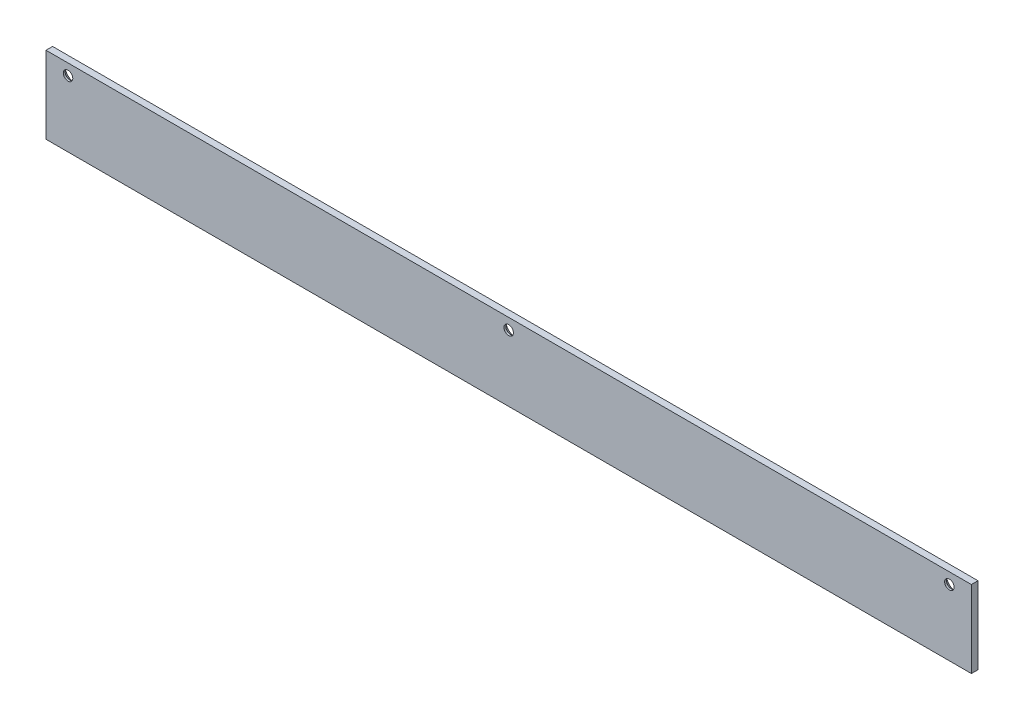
SolidWorks part; units mm, degrees
ref_plane "Спереди" through (0, 0, 0) normal (0, 0, 1) x (1, 0, 0)
ref_plane "Сверху" through (0, 0, 0) normal (0, 1, 0) x (1, 0, 0)
ref_plane "Справа" through (0, 0, 0) normal (1, 0, 0) x (0, 0, -1)
sketch "Эскиз1" plane through (0, 0, 0) normal (0, 0, 1) x (1, 0, 0)
  line L1 (0, 0) -> (420, 0)
  line L2 (0, 0) -> (0, 35)
  line L3 (0, 35) -> (420, 35)
  line L4 (420, 0) -> (420, 35)
  dimension "D1" = 35
  dimension "D2" = 420
extrude "Бобышка-Вытянуть1" add sketch "Эскиз1" along normal blind 3
sketch "Эскиз2" plane through (0, 0, 0) normal (0, 0, -1) x (-1, 0, 0)
  line L0 (-420, 0) -> (-420, 35) construction
  line L1 (-420, 35) -> (0, 35) construction
  circle A0 centre (-410, 30) radius 4.3
  circle A1 centre (-210, 30) radius 4.3
  circle A2 centre (-10, 30) radius 4.3
  dimension "D1" = 8.6
  dimension "D2" = 8.6
  dimension "D3" = 8.6
  dimension "D4" = 10
  dimension "D5" = 5
  dimension "D6" = 5
  dimension "D7" = 5
  dimension "D8" = 200
  dimension "D9" = 200
extrude "Вырез-Вытянуть1" cut sketch "Эскиз2" against normal blind 2.15
draft "Уклон1" type of draft neutral plane draft angle 45 faces to draft 3 parameters "D1"=45
sketch "Эскиз4" plane through (0, 0, 2.15) normal (0, 0, -1) x (-1, 0, 0)
  circle A0 centre (-410, 30) radius 2.15
  dimension "D1" = 4.3
extrude "Вырез-Вытянуть2" cut sketch "Эскиз4" against normal through all
sketch "Эскиз5" plane through (0, 0, 2.15) normal (0, 0, -1) x (-1, 0, 0)
  circle A1 centre (-210, 30) radius 2.15
  dimension "D1" = 4.3
extrude "Вырез-Вытянуть3" cut sketch "Эскиз5" against normal through all
sketch "Эскиз6" plane through (0, 0, 2.15) normal (0, 0, -1) x (-1, 0, 0)
  circle A0 centre (-10, 30) radius 2.15
  dimension "D1" = 4.3
extrude "Вырез-Вытянуть4" cut sketch "Эскиз6" against normal through all
